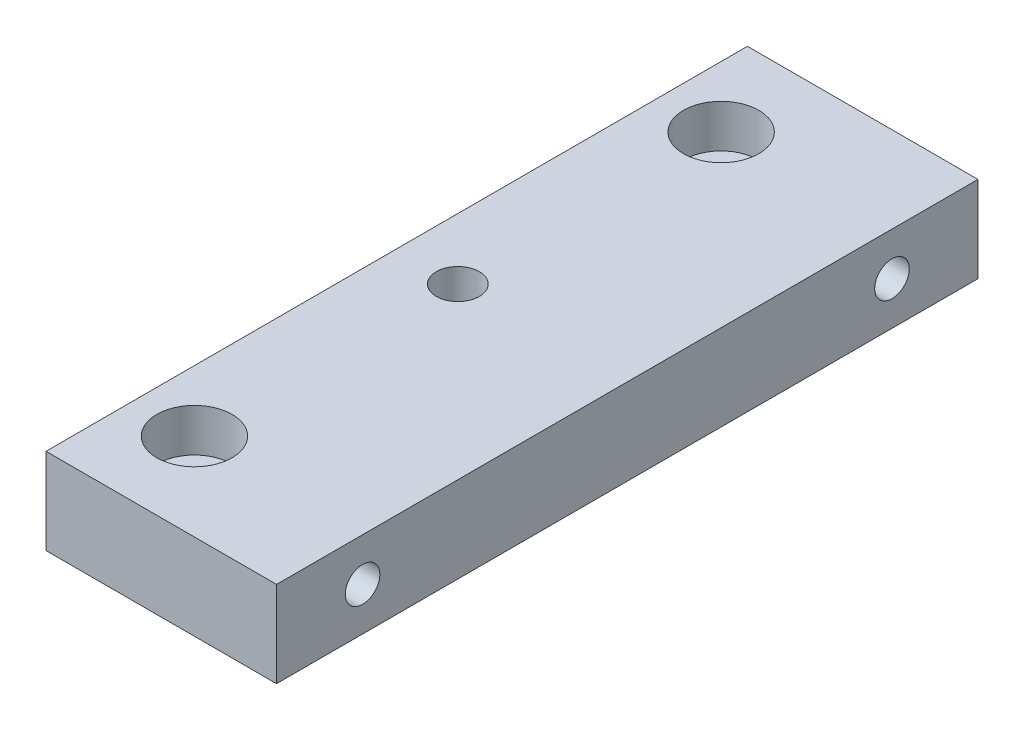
SolidWorks part; units mm, degrees
ref_plane "Front Plane" through (0, 0, 0) normal (0, 0, 1) x (1, 0, 0)
ref_plane "Top Plane" through (0, 0, 0) normal (0, 1, 0) x (1, 0, 0)
ref_plane "Right Plane" through (0, 0, 0) normal (1, 0, 0) x (0, 0, -1)
sketch "Sketch1" plane through (0, 0, 0) normal (0, 1, 0) x (1, 0, 0)
  line L1 (-17.0212, 51.7906) -> (17.0212, 51.7906)
  line L2 (-17.0212, 51.7906) -> (-17.0212, -51.7906)
  line L3 (-17.0212, -51.7906) -> (17.0212, -51.7906)
  line L4 (17.0212, 51.7906) -> (17.0212, -51.7906)
  line L5 (-17.0212, 51.7906) -> (17.0212, -51.7906) construction
  line L6 (-17.0212, -51.7906) -> (17.0212, 51.7906) construction
  point P0 (0, 0)
  dimension "D1" = 34.0423
  dimension "D2" = 103.5812
extrude "Boss-Extrude1" add sketch "Sketch1" along normal mid plane 12.7
hole_wizard "CBORE for 1/4 Socket Head Cap Screw1" positions "Sketch2" profile "Sketch3" counterbore size "1/4" standard "ANSI Inch"
sketch "Sketch2" plane through (0, 6.35, 0) normal (0, 1, 0) x (1, 0, 0)
  point P0 (-8.0042, -38.8874)
  point P3 (-8.0042, 38.8874)
sketch "Sketch3" plane through (-8.0042, 6.35, 38.8874) normal (1, 0, 0) x (0, 0, 1)
  line L0 (0, 0) -> (0, 12.7)
  line L1 (0, 12.7) -> (3.3782, 12.7)
  line L3 (3.3782, 12.7) -> (3.3782, 6.35)
  line L4 (3.3782, 6.35) -> (5.5562, 6.35)
  line L5 (5.5562, 6.35) -> (5.5562, 0)
  line L7 (5.5562, 0) -> (0, 0)
  line L11 (0, -6.35) -> (0, 107.95) construction
  dimension "Thru Hole Dia." = 6.7564
  dimension "Thru Hole Depth" = 12.7
  dimension "C'Bore Dia." = 11.1125
  dimension "C'Bore Depth" = 6.35
hole_wizard "1/4 (0.2500) Dowel Hole1" positions "Sketch4" profile "Sketch5" hole size "1/4" standard "ANSI Inch"
sketch "Sketch4" plane through (0, -6.35, 0) normal (0, -1, 0) x (-1, 0, 0)
  point P0 (8.0042, 0)
sketch "Sketch5" plane through (-8.0042, -6.35, 0) normal (1, 0, 0) x (0, 0, -1)
  line L0 (0, 0) -> (0, 12.7)
  line L1 (0, 12.7) -> (3.175, 12.7)
  line L2 (3.175, 12.7) -> (3.175, 0)
  line L5 (3.175, 0) -> (0, 0)
  line L11 (0, -6.35) -> (0, 107.95) construction
  dimension "Thru Hole Dia." = 6.35
  dimension "Thru Hole Depth" = 12.7
hole_wizard "1/4-20 Tapped Hole1" positions "Sketch6" profile "Sketch7" tap size "1/4-20" standard "ANSI Inch"
sketch "Sketch6" plane through (17.0212, 0, 0) normal (1, 0, 0) x (0, 0, -1)
  line L0 (0, -6.35) -> (0, -18.6443) construction
  line L1 (-51.7906, -6.35) -> (51.7906, -6.35) construction
  line L3 (51.7906, 0) -> (39.0906, 0) construction
  line L4 (51.7906, 6.35) -> (51.7906, -6.35) construction
  point P0 (39.0906, 0)
  point P9 (-39.0906, 0)
  dimension "D1" = 12.7
sketch "Sketch7" plane through (17.0212, 0, -39.0906) normal (0, 1, 0) x (0, 0, -1)
  line L0 (0, 0) -> (0, 18.0438)
  line L1 (0, 18.0438) -> (2.5527, 16.51)
  line L2 (2.5527, 16.51) -> (2.5527, 0)
  line L5 (2.5527, 0) -> (0, 0)
  line L10 (0, 18.0438) -> (-2.5527, 16.51) construction
  line L11 (0, -6.35) -> (0, 107.95) construction
  dimension "Tap Drill Dia." = 5.1054
  dimension "Tap Drill Depth" = 16.51
  dimension "Drill Angle" = 118
